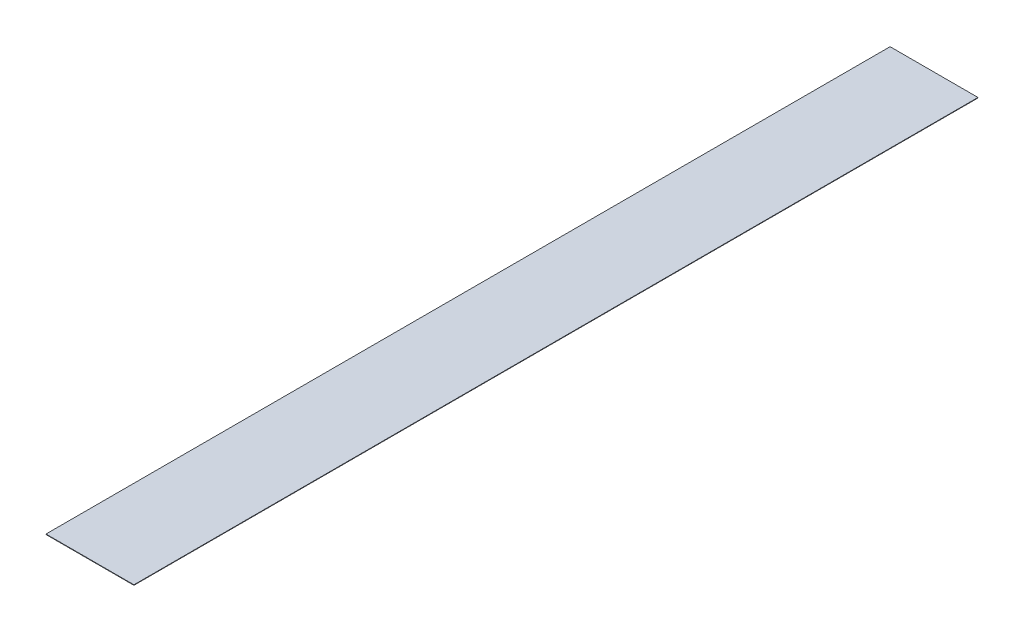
SolidWorks part; units mm, degrees
ref_plane "Front Plane" through (0, 0, 0) normal (0, 0, 1) x (1, 0, 0)
ref_plane "Top Plane" through (0, 0, 0) normal (0, 1, 0) x (1, 0, 0)
ref_plane "Right Plane" through (0, 0, 0) normal (1, 0, 0) x (0, 0, -1)
sketch "Sketch1" plane through (0, 0, 0) normal (0, 1, 0) x (1, 0, 0)
  line L0 (-55, 0) -> (55, 0) construction
  line L1 (0, -55) -> (0, 55) construction
  line L5 (23.8125, -228.6) -> (-23.8125, -228.6)
  line L6 (23.8125, -228.6) -> (23.8125, 228.6)
  line L7 (23.8125, 228.6) -> (-23.8125, 228.6)
  line L8 (-23.8125, -228.6) -> (-23.8125, 228.6)
  point P2 (23.8125, 0)
  point P9 (0, -228.6)
  dimension "D1" = 457.2
  dimension "D2" = 47.625
extrude "Boss-Extrude1" add sketch "Sketch1" along normal blind 0.254
